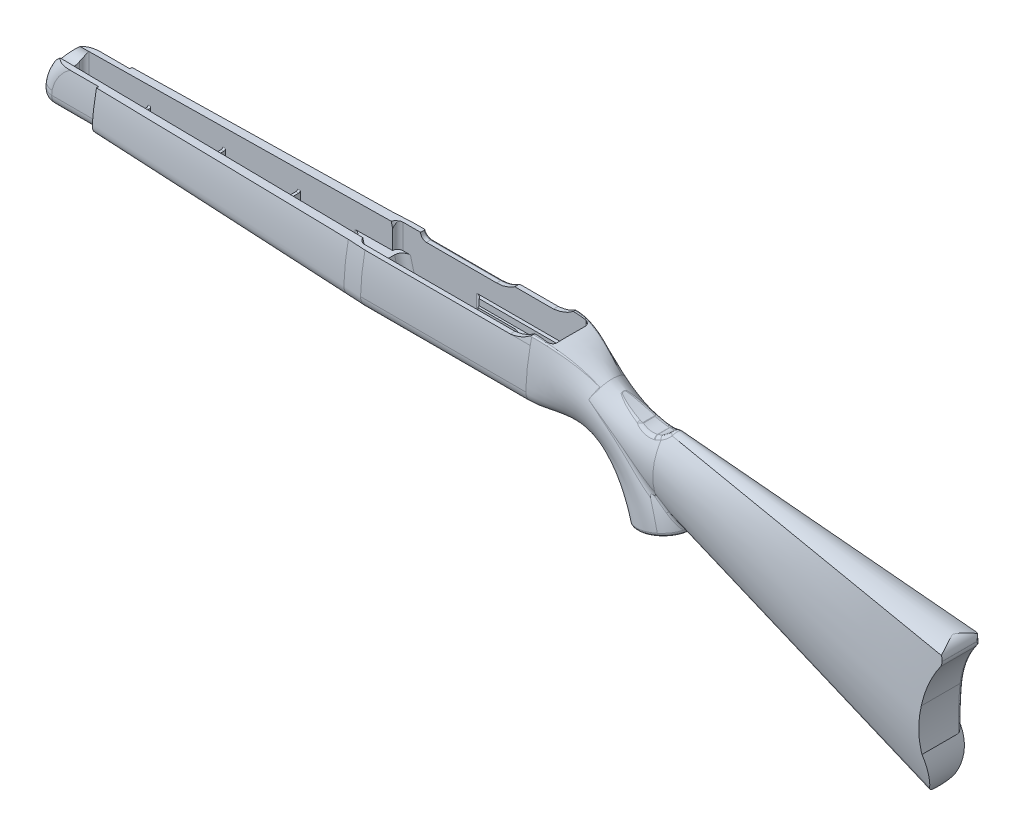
SolidWorks part; units mm, degrees
ref_plane "Front Plane" through (0, 0, 0) normal (0, 0, 1) x (1, 0, 0)
ref_plane "Top Plane" through (0, 0, 0) normal (0, 1, 0) x (1, 0, 0)
ref_plane "Right Plane" through (0, 0, 0) normal (1, 0, 0) x (0, 0, -1)
imported_body "Imported3"
draft "Draft1" type of draft neutral plane draft angle 0.033 faces to draft 1 parameters "D1"=0.033
draft "Draft2" type of draft neutral plane draft angle 0.8 faces to draft 4 parameters "D1"=0.8
draft "Draft3" type of draft neutral plane draft angle 0.8 faces to draft 4 parameters "D1"=0.8
ref_plane "Plane4" through (-488.2553, 0, 0) normal (1, 0, 0) x (0, 1, 0)
sketch "Sketch1" plane through (-488.2553, 0, 0) normal (1, 0, 0) x (0, 1, 0)
  line L0 (10.6442, 0) -> (10.6442, -4.191)
  line L1 (10.6442, -4.191) -> (15.868, -4.191)
  line L2 (15.868, -4.191) -> (15.868, -2.2352)
  line L3 (15.868, -2.2352) -> (17.773, -2.2352)
  line L4 (17.773, -2.2352) -> (17.773, -3.2385)
  line L5 (17.773, -3.2385) -> (31.9462, -3.2385)
  line L6 (31.9462, -3.2385) -> (31.9462, 0)
  line L7 (31.9462, 0) -> (10.6442, 0)
  line L8 (31.9462, 0) -> (10.6442, 0) construction
revolve "Cut-Revolve1" cut sketch "Sketch1" angle 360 about L8
fillet "Fillet1" radius 3.81 12 edges at (-724.6531, 38.6518, -8.1534) (-724.6531, 25.1644, 0) (-724.6531, 38.6518, 8.1534) (-249.4772, 26.8694, 7.3178) (-249.9024, 26.9586, -7.2991) (-255.0555, 28.8511, 0) (-233.6875, 32.1475, -0.2834) (-243.0675, 26.6202, 0)
fillet "Fillet2" radius 5.588 4 edges at (-500.9553, 23.6795, -11.2776) (-594.9494, 19.334, -9.9649) (-594.9494, 19.334, 9.9649) (-500.9553, 23.6795, 11.2776)
fillet "Fillet3" radius 1.27 10 edges at (-611.9787, 36.5182, -9.727) (-302.7636, 50.5692, 13.0104) (-286.3514, 40.3681, 8.9346) (-294.9945, 46.18, -10.9138) (-286.3085, 40.2524, -9.0232) (-551.7045, 36.5182, -10.5688) (-672.2529, 36.5182, -8.8852) (-611.9787, 36.5182, 9.727) (-672.2529, 36.5182, 8.8852) (-551.7045, 36.5182, 10.5688)
fillet "Fillet4" radius 2.7938 5 edges at (-257.0315, 29.5676, 5.8112) (-275.9878, 38.2262, 0.3769) (-256.0582, 29.2106, -5.5553)
fillet "Fillet6" radius 3.175 2 edges
fillet "Fillet7" radius 4.064 4 edges at (-321.6821, 29.4316, -12.9032) (-321.6821, 29.4316, 12.9032) (-318.8373, 44.381, 15.748) (-318.8373, 44.381, -15.748)
